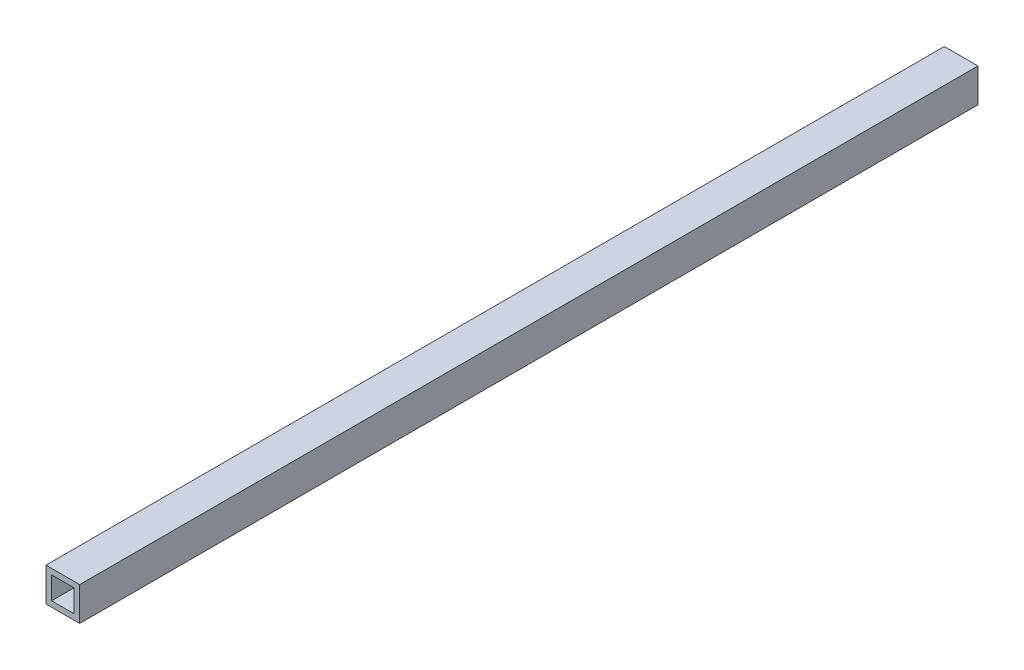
SolidWorks part; units mm, degrees
ref_plane "Front Plane" through (0, 0, 0) normal (0, 0, 1) x (1, 0, 0)
ref_plane "Top Plane" through (0, 0, 0) normal (0, 1, 0) x (1, 0, 0)
ref_plane "Right Plane" through (0, 0, 0) normal (1, 0, 0) x (0, 0, -1)
sketch "Sketch1" plane through (0, 0, 0) normal (0, 0, 1) x (1, 0, 0)
  line L0 (-6.35, 6.35) -> (6.35, 6.35)
  line L1 (-9.525, -9.525) -> (9.525, -9.525)
  line L2 (-9.525, -9.525) -> (-9.525, 9.525)
  line L3 (-9.525, 9.525) -> (9.525, 9.525)
  line L4 (9.525, -9.525) -> (9.525, 9.525)
  line L5 (-9.525, -9.525) -> (9.525, 9.525) construction
  line L6 (-9.525, 9.525) -> (9.525, -9.525) construction
  line L7 (6.35, -6.35) -> (6.35, 6.35)
  line L8 (-6.35, -6.35) -> (6.35, -6.35)
  line L9 (-6.35, -6.35) -> (-6.35, 6.35)
  point P0 (0, 0)
  dimension "D1" = 19.05
  dimension "D2" = 19.05
  dimension "D3" = 3.175
extrude "Boss-Extrude1" add sketch "Sketch1" against normal blind 508
sketch "Sketch2" plane through (-9.525, 0, 0) normal (-1, 0, 0) x (0, 0, 1)
  line L0 (-508, 0) -> (0, 0) construction
  line L1 (-508, 9.525) -> (-508, -9.525) construction
  line L2 (-482.6, 0) -> (-152.4, 0) construction
  line L3 (-482.6, 3.175) -> (-152.4, 3.175)
  line L4 (-482.6, -3.175) -> (-152.4, -3.175)
  arc A0 (-482.6, 3.175) -> (-482.6, -3.175) centre (-482.6, 0) ccw
  arc A1 (-152.4, -3.175) -> (-152.4, 3.175) centre (-152.4, 0) ccw
  point P7 (-317.5, 0)
  dimension "D1" = 3.175
  dimension "D2" = 25.4
  dimension "D3" = 330.2
extrude "Cut-Extrude1" cut sketch "Sketch2" against normal up to next
